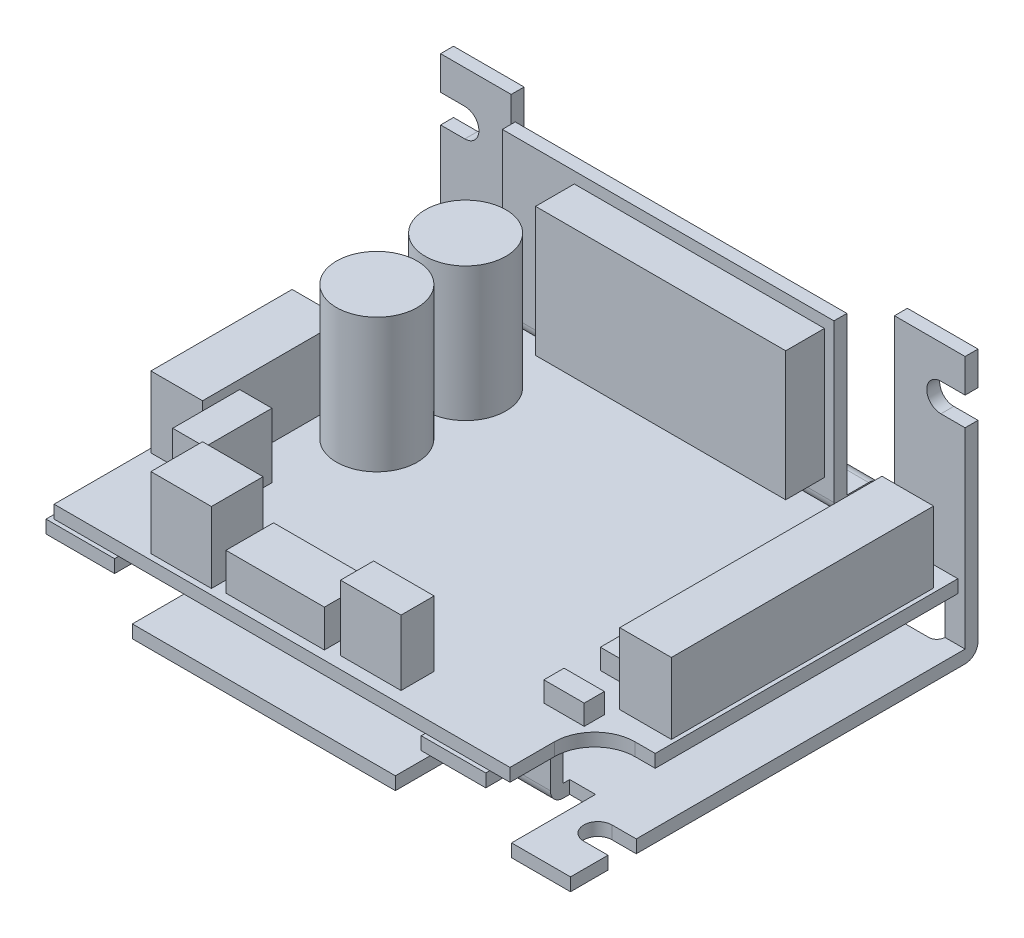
SolidWorks part; units mm, degrees
ref_plane "正面" through (0, 0, 0) normal (0, 0, 1) x (1, 0, 0)
ref_plane "平面" through (0, 0, 0) normal (0, 1, 0) x (1, 0, 0)
ref_plane "右側面" through (0, 0, 0) normal (1, 0, 0) x (0, 0, -1)
sketch "ｽｹｯﾁ1" plane through (0, 0, 0) normal (0, 1, 0) x (1, 0, 0)
  line L0 (-29.5, 42.9555) -> (-29.5, -49957.0445) construction
  line L1 (-32.5, -25.25) -> (32.5, -25.25) construction
  line L2 (-32.5, -25.25) -> (-32.5, 25.25) construction
  line L3 (-32.5, 25.25) -> (32.5, 25.25) construction
  line L4 (32.5, -25.25) -> (32.5, 25.25) construction
  line L5 (-32.5, -25.25) -> (32.5, 25.25) construction
  line L6 (-32.5, 25.25) -> (32.5, -25.25) construction
  line L7 (29.5, 46.0859) -> (29.5, -49953.9141) construction
  line L8 (-48.6184, 12.15) -> (49951.3816, 12.15) construction
  line L9 (-59.4008, -18.85) -> (49940.5992, -18.85) construction
  line L10 (-70.1832, -14.85) -> (49929.8168, -14.85) construction
  line L11 (-29.5, 13.9) -> (-32.5, 13.9) construction
  line L12 (-29.5, 10.4) -> (-32.5, 10.4) construction
  line L13 (29.5, -17.1) -> (32.5, -17.1) construction
  line L14 (29.5, -20.6) -> (32.5, -20.6) construction
  line L15 (-21.8, -14.85) -> (-21.8, -25.25) construction
  line L16 (10.8, -14.85) -> (10.8, -25.25) construction
  line L17 (25.2, -14.85) -> (25.2, -25.25) construction
  line L18 (-32.5, 25.25) -> (-32.5, 13.9)
  line L19 (-32.5, 13.9) -> (-29.5, 13.9)
  line L20 (-29.5, 10.4) -> (-32.5, 10.4)
  line L21 (-32.5, 10.4) -> (-32.5, -17.25)
  line L22 (-32.5, -17.25) -> (-24, -17.25)
  line L23 (-21.8, -14.85) -> (-21.8, -25.25)
  line L24 (-21.8, -25.25) -> (10.8, -25.25)
  line L25 (10.8, -25.25) -> (10.8, -14.85)
  line L26 (14, -14.85) -> (14, -25.25) construction
  line L27 (25.2, -14.85) -> (25.2, -25.25)
  line L28 (25.2, -25.25) -> (32.5, -25.25)
  line L29 (32.5, -25.25) -> (32.5, -20.6)
  line L30 (32.5, -20.6) -> (29.5, -20.6)
  line L31 (29.5, -17.1) -> (32.5, -17.1)
  line L32 (32.5, -17.1) -> (32.5, 25.25)
  line L33 (-54.6043, -17.25) -> (49945.3957, -17.25) construction
  line L34 (-24, -14.85) -> (-24, -25.25) construction
  line L35 (-24, -17.25) -> (-24, -14.85)
  line L36 (-24, -14.85) -> (-21.8, -14.85)
  line L37 (22, -14.85) -> (22, -25.25) construction
  line L38 (10.8, -14.85) -> (14, -14.85)
  line L39 (14, -14.85) -> (14, -17.25)
  line L40 (14, -17.25) -> (22, -17.25)
  line L41 (22, -17.25) -> (22, -14.85)
  line L42 (22, -14.85) -> (25.2, -14.85)
  line L43 (19.5, 21.0496) -> (19.5, -49978.9504) construction
  line L44 (7.8325, -3.75) -> (-49992.1675, -3.75) construction
  line L45 (37.8288, 22.65) -> (50037.8288, 22.65) construction
  line L46 (18.5, -3.75) -> (-14, -3.75)
  line L47 (19.5, -2.75) -> (19.5, 17.25)
  line L48 (16.5, 20.25) -> (-12, 20.25)
  line L49 (-15, -2.75) -> (-15, 17.25)
  line L50 (30, 25.25) -> (30, 22.65) construction
  line L51 (21, 25.25) -> (21, 22.65) construction
  line L52 (-29, 25.25) -> (-29, 22.65) construction
  line L53 (-17, 25.25) -> (-17, 22.65) construction
  line L54 (-32.5, 25.25) -> (-29, 25.25)
  line L55 (-29, 25.25) -> (-29, 23.65)
  line L56 (-28, 22.65) -> (-18, 22.65)
  line L57 (-17, 23.65) -> (-17, 25.25)
  line L58 (-17, 25.25) -> (21, 25.25)
  line L59 (21, 25.25) -> (21, 23.65)
  line L60 (22, 22.65) -> (29, 22.65)
  line L61 (30, 23.65) -> (30, 25.25)
  line L62 (30, 25.25) -> (32.5, 25.25)
  circle A0 centre (-29.5, 12.15) radius 1.75 construction
  circle A1 centre (29.5, -18.85) radius 1.75 construction
  arc A2 (-29.5, 13.9) -> (-29.5, 10.4) centre (-29.5, 12.15) cw
  arc A3 (29.5, -20.6) -> (29.5, -17.1) centre (29.5, -18.85) cw
  arc A4 (18.5, -3.75) -> (19.5, -2.75) centre (18.5, -2.75) ccw
  arc A5 (-14, -3.75) -> (-15, -2.75) centre (-14, -2.75) cw
  arc A6 (19.5, 17.25) -> (16.5, 20.25) centre (16.5, 17.25) ccw
  arc A7 (-12, 20.25) -> (-15, 17.25) centre (-12, 17.25) ccw
  arc A8 (-29, 23.65) -> (-28, 22.65) centre (-28, 23.65) ccw
  arc A9 (-18, 22.65) -> (-17, 23.65) centre (-18, 23.65) ccw
  arc A10 (21, 23.65) -> (22, 22.65) centre (22, 23.65) ccw
  arc A11 (29, 22.65) -> (30, 23.65) centre (29, 23.65) ccw
  point P0 (0, 0)
  point P58 (19.5, -3.75)
  point P61 (-15, -3.75)
  point P64 (19.5, 20.25)
  point P67 (-15, 20.25)
  dimension "D7" = 3.5
  dimension "D9" = 3.5
  dimension "D21" = 1
  dimension "D22" = 3
  dimension "D28" = 1
  dimension "D1" = 65
  dimension "D2" = 50.5
  dimension "D3" = 3
  dimension "D4" = 6.4
  dimension "D5" = 10.4
  dimension "D6" = 31
  dimension "D8" = 3
  dimension "D10" = 10.7
  dimension "D11" = 7.3
  dimension "D12" = 14.4
  dimension "D13" = 8
  dimension "D14" = 8.5
  dimension "D15" = 3.2
  dimension "D16" = 3.2
  dimension "D17" = 13
  dimension "D18" = 29
  dimension "D19" = 34.5
  dimension "D20" = 24
  dimension "D23" = 2.6
  dimension "D24" = 2.5
  dimension "D25" = 9
  dimension "D26" = 38
  dimension "D27" = 12
extrude "押し出し1" add sketch "ｽｹｯﾁ1" along normal blind 1.6
fillet "ﾌｨﾚｯﾄ1" radius 1.6 5 edges at (-30.75, 0, -25.25) (2, 0, -25.25) (31.25, 0, -25.25) (-28.25, 0, 17.25) (18, 0, 17.25)
sketch "ｽｹｯﾁ2" plane through (0, 1.6, 0) normal (0, 1, 0) x (1, 0, 0)
  line L0 (-17.8324, -15.65) -> (49982.1676, -15.65) construction
  line L1 (-32.5, -17.25) -> (-24, -17.25) construction
  line L3 (-32.5, -17.25) -> (-24, -17.25)
  line L4 (-32.5, -17.25) -> (-32.5, -15.65)
  line L5 (-32.5, -15.65) -> (-24, -15.65)
  line L6 (-24, -17.25) -> (-24, -15.65)
  line L7 (14, -17.25) -> (22, -17.25)
  line L8 (14, -17.25) -> (14, -15.65)
  line L9 (14, -15.65) -> (22, -15.65)
  line L10 (22, -17.25) -> (22, -15.65)
  dimension "D1" = 1.6
extrude "押し出し2" add sketch "ｽｹｯﾁ2" along normal blind 5.9
fillet "ﾌｨﾚｯﾄ2" radius 1.6 2 edges at (18, 7.5, 15.65) (-28.25, 7.5, 15.65)
sketch "ｽｹｯﾁ3" plane through (0, 0, 17.25) normal (0, 0, 1) x (1, 0, 0)
  line L0 (22, 7.5) -> (22, 1.6) construction
  line L1 (-32.5, 7.5) -> (-24, 7.5)
  line L2 (-32.5, 7.5) -> (-32.5, 5.9)
  line L3 (-32.5, 5.9) -> (-24, 5.9)
  line L4 (-24, 7.5) -> (-24, 5.9)
  line L5 (14, 7.5) -> (22, 7.5)
  line L6 (14, 7.5) -> (14, 5.9)
  line L7 (14, 5.9) -> (22, 5.9)
  line L8 (22, 7.5) -> (22, 5.9)
  dimension "D1" = 1.6
extrude "押し出し3" add sketch "ｽｹｯﾁ3" along normal blind 8
sketch "ｽｹｯﾁ5" plane through (0, 1.6, 0) normal (0, 1, 0) x (1, 0, 0)
  line L0 (-7.8811, 23.65) -> (49992.1189, 23.65) construction
  line L1 (21, 25.25) -> (-17, 25.25) construction
  line L2 (30, 23.65) -> (30, 25.25)
  line L3 (30, 25.25) -> (32.5, 25.25)
  line L4 (32.5, 25.25) -> (32.5, 23.65)
  line L5 (32.5, 23.65) -> (30, 23.65)
  line L6 (21, 23.65) -> (21, 25.25)
  line L7 (21, 25.25) -> (-17, 25.25)
  line L8 (-17, 25.25) -> (-17, 23.65)
  line L9 (-17, 23.65) -> (21, 23.65)
  line L10 (-29, 23.65) -> (-29, 25.25)
  line L11 (-29, 25.25) -> (-32.5, 25.25)
  line L12 (-32.5, 25.25) -> (-32.5, 23.65)
  line L13 (-32.5, 23.65) -> (-29, 23.65)
  dimension "D1" = 1.6
extrude "押し出し5" add sketch "ｽｹｯﾁ5" along normal blind 6.7
sketch "ｽｹｯﾁ6" plane through (0, 8.3, 0) normal (0, 1, 0) x (1, 0, 0)
  line L1 (-32.5, 23.65) -> (32.5, 23.65)
  line L2 (-32.5, 23.65) -> (-32.5, 25.25)
  line L3 (-32.5, 25.25) -> (32.5, 25.25)
  line L4 (32.5, 23.65) -> (32.5, 25.25)
extrude "押し出し6" add sketch "ｽｹｯﾁ6" along normal blind 2.8
sketch "ｽｹｯﾁ7" plane through (0, 8.3, 0) normal (0, -1, 0) x (1, 0, 0)
  line L0 (30, -25.25) -> (21, -25.25) construction
  line L1 (24, -25.25) -> (27, -25.25)
  line L2 (24, -25.25) -> (24, -23.65)
  line L3 (24, -23.65) -> (27, -23.65)
  line L4 (27, -25.25) -> (27, -23.65)
  line L5 (21, -23.65) -> (30, -23.65) construction
  line L6 (30, -23.65) -> (30, -25.25) construction
  line L7 (-17, -25.25) -> (-29, -25.25) construction
  line L8 (-26, -25.25) -> (-20, -25.25)
  line L9 (-26, -25.25) -> (-26, -23.65)
  line L10 (-26, -23.65) -> (-20, -23.65)
  line L11 (-20, -25.25) -> (-20, -23.65)
  line L12 (-29, -23.65) -> (-17, -23.65) construction
  line L13 (-17, -25.25) -> (-17, -23.65) construction
  dimension "D1" = 3
  dimension "D2" = 3
  dimension "D3" = 3
  dimension "D4" = 6
extrude "押し出し7" add sketch "ｽｹｯﾁ7" along normal blind 2.4
fillet "ﾌｨﾚｯﾄ4" radius 1.6 2 edges at (25.5, 5.9, -25.25) (-23, 5.9, -25.25)
sketch "ｽｹｯﾁ8" plane through (0, 0, -23.65) normal (0, 0, 1) x (1, 0, 0)
  line L0 (-24, 7.5) -> (-32.5, 7.5) construction
  line L1 (24, 5.9) -> (27, 5.9)
  line L2 (24, 5.9) -> (24, 7.5)
  line L3 (24, 7.5) -> (27, 7.5)
  line L4 (27, 5.9) -> (27, 7.5)
  line L5 (-20, 5.9) -> (-26, 5.9)
  line L6 (-20, 5.9) -> (-20, 7.5)
  line L7 (-20, 7.5) -> (-26, 7.5)
  line L8 (-26, 5.9) -> (-26, 7.5)
  line L9 (-26, 5.9) -> (-26, 8.3) construction
extrude "押し出し8" add sketch "ｽｹｯﾁ8" along normal blind 3.4
sketch "ｽｹｯﾁ9" plane through (0, 11.1, 0) normal (0, 1, 0) x (1, 0, 0)
  line L0 (-32.5, 23.65) -> (32.5, 23.65) construction
  line L1 (32.5, 25.25) -> (23.75, 25.25)
  line L2 (32.5, 25.25) -> (32.5, 23.65)
  line L3 (32.5, 23.65) -> (23.75, 23.65)
  line L4 (23.75, 25.25) -> (23.75, 23.65)
  line L5 (32.5, 25.25) -> (-32.5, 25.25) construction
  line L6 (-32.5, 23.65) -> (-23.75, 23.65)
  line L7 (-32.5, 23.65) -> (-32.5, 25.25)
  line L8 (-32.5, 25.25) -> (-23.75, 25.25)
  line L9 (-23.75, 23.65) -> (-23.75, 25.25)
  dimension "D1" = 8.75
  dimension "D2" = 8.75
extrude "押し出し9" add sketch "ｽｹｯﾁ9" along normal blind 21.9
sketch "ｽｹｯﾁ12" plane through (0, 0, -23.65) normal (0, 0, 1) x (1, 0, 0)
  line L0 (-29.6108, 28.85) -> (49970.3892, 28.85) construction
  line L3 (-32.5, 33) -> (-23.75, 33) construction
  line L4 (-46.3034, 25.35) -> (49953.6966, 25.35) construction
  line L5 (-29.5, 45.2209) -> (-29.5, -49954.7791) construction
  line L6 (29.5, 54.6181) -> (29.5, -49945.3819) construction
  line L7 (-32.5, 33) -> (-32.5, 1.6) construction
  line L8 (32.5, 33) -> (32.5, 1.6) construction
  line L9 (-41.0484, 27.1) -> (49958.9516, 27.1) construction
  line L10 (-29.5, 25.35) -> (-32.5, 25.35)
  line L11 (-32.5, 25.35) -> (-32.5, 28.85)
  line L12 (-32.5, 28.85) -> (-29.5, 28.85)
  line L13 (32.5, 25.35) -> (29.5, 25.35)
  line L14 (29.5, 28.85) -> (32.5, 28.85)
  line L15 (32.5, 28.85) -> (32.5, 25.35)
  circle A0 centre (-29.5, 27.1) radius 1.75 construction
  circle A1 centre (29.5, 27.1) radius 1.75 construction
  arc A2 (-29.5, 28.85) -> (-29.5, 25.35) centre (-29.5, 27.1) cw
  arc A3 (29.5, 25.35) -> (29.5, 28.85) centre (29.5, 27.1) cw
  dimension "D6" = 3.5
  dimension "D7" = 3.5
  dimension "D1" = 4.15
  dimension "D2" = 3.5
  dimension "D3" = 3
  dimension "D4" = 3
  dimension "D5" = 1.75
extrude "押し出し10" cut sketch "ｽｹｯﾁ12" against normal up to next
sketch "ｽｹｯﾁ13" plane through (0, 11.1, 0) normal (0, 1, 0) x (1, 0, 0)
  line L0 (23.75, 25.25) -> (-23.75, 25.25) construction
  line L1 (20.55, 25.25) -> (-20.55, 25.25)
  line L2 (20.55, 25.25) -> (20.55, 23.65)
  line L3 (20.55, 23.65) -> (-20.55, 23.65)
  line L4 (-20.55, 25.25) -> (-20.55, 23.65)
  line L5 (-17, 23.65) -> (21, 23.65) construction
  line L6 (32.5, 23.65) -> (32.5, 25.25) construction
  dimension "D1" = 11.95
  dimension "D2" = 41.1
extrude "押し出し11" add sketch "ｽｹｯﾁ13" along normal blind 2.4
fillet "ﾌｨﾚｯﾄ5" radius 1.6 1 edges at (0, 13.5, -25.25)
sketch "ｽｹｯﾁ14" plane through (0, 0, -23.65) normal (0, 0, 1) x (1, 0, 0)
  line L1 (-20.55, 13.5) -> (20.55, 13.5)
  line L2 (-20.55, 13.5) -> (-20.55, 11.9)
  line L3 (-20.55, 11.9) -> (20.55, 11.9)
  line L4 (20.55, 13.5) -> (20.55, 11.9)
extrude "押し出し12" add sketch "ｽｹｯﾁ14" along normal blind 4.3
fillet "ﾌｨﾚｯﾄ6" radius 1.6 1 edges at (0, 11.9, -19.35)
sketch "ｽｹｯﾁ15" plane through (0, 13.5, 0) normal (0, 1, 0) x (1, 0, 0)
  line L0 (20.55, 19.35) -> (20.55, 23.65) construction
  line L1 (-20.55, 19.35) -> (20.55, 19.35)
  line L2 (-20.55, 19.35) -> (-20.55, 20.95)
  line L3 (-20.55, 20.95) -> (20.55, 20.95)
  line L4 (20.55, 19.35) -> (20.55, 20.95)
  dimension "D1" = 1.6
extrude "押し出し13" add sketch "ｽｹｯﾁ15" along normal up to surface (19.5 mm away)
sketch "Sketch1" plane through (0, 7.5, 0) normal (0, 1, 0) x (1, 0, 0)
  line L0 (-32, -24.75) -> (32, -24.75)
  line L1 (32, -24.75) -> (32, 23.25)
  line L2 (32, 23.25) -> (-32, 23.25)
  line L3 (-32, 23.25) -> (-32, -24.75)
  line L4 (-32.5, -25.25) -> (-32.5, -17.25) construction
  line L5 (-24, -25.25) -> (-32.5, -25.25) construction
  line L6 (24.5, -24.75) -> (24.5, -19.25)
  line L7 (29.5, -14.25) -> (32, -14.25)
  line L8 (-24.5, 23.25) -> (-24.5, 11.75)
  line L9 (-29.5, 6.75) -> (-32, 6.75)
  arc A0 (29.5, -14.25) -> (24.5, -19.25) centre (29.5, -19.25) ccw
  arc A1 (-24.5, 11.75) -> (-29.5, 6.75) centre (-29.5, 11.75) cw
  dimension "D9" = 5
  dimension "D1" = 48
  dimension "D2" = 64
  dimension "D3" = 0.5
  dimension "D4" = 0.5
  dimension "D5" = 56.5
  dimension "D6" = 31.5
  dimension "D7" = 10.5
  dimension "D8" = 7.5
extrude "Extrude1" add sketch "Sketch1" along normal blind 1.6 separate body
sketch "Sketch2" plane through (0, 9.1, 0) normal (0, 1, 0) x (1, 0, 0)
  line L0 (-24, -25.25) -> (-32.5, -25.25) construction
  line L1 (-20.7, -17.65) -> (-13.2, -17.65)
  line L2 (-20.7, -17.65) -> (-20.7, -24.05)
  line L3 (-20.7, -24.05) -> (-13.2, -24.05)
  line L4 (-13.2, -17.65) -> (-13.2, -24.05)
  line L5 (-32.5, -25.25) -> (-32.5, -17.25) construction
  dimension "D1" = 6.4
  dimension "D2" = 7.5
  dimension "D3" = 1.2
  dimension "D4" = 11.8
extrude "Extrude2" add sketch "Sketch2" along normal blind 8.8
sketch "Sketch3" plane through (0, 9.1, 0) normal (0, 1, 0) x (-1, 0, 0)
  line L0 (21.8, 25.25) -> (-10.8, 25.25) construction
  line L1 (11.8, 17.75) -> (-0.4, 17.75)
  line L2 (11.8, 17.75) -> (11.8, 23.65)
  line L3 (11.8, 23.65) -> (-0.4, 23.65)
  line L4 (-0.4, 17.75) -> (-0.4, 23.65)
  line L6 (13.2, 24.05) -> (13.2, 17.65) construction
  dimension "D1" = 5.9
  dimension "D2" = 1.6
  dimension "D3" = 1.4
  dimension "D4" = 12.2
extrude "Extrude3" add sketch "Sketch3" along normal blind 4.6
sketch "Sketch4" plane through (0, 9.1, 0) normal (0, 1, 0) x (1, 0, 0)
  line L0 (-21.8, -25.25) -> (10.8, -25.25) construction
  line L1 (2, -19.15) -> (9.5, -19.15)
  line L2 (2, -19.15) -> (2, -23.25)
  line L3 (2, -23.25) -> (9.5, -23.25)
  line L4 (9.5, -19.15) -> (9.5, -23.25)
  line L5 (-32.5, -25.25) -> (-32.5, -17.25) construction
  dimension "D1" = 7.5
  dimension "D2" = 2
  dimension "D3" = 4.1
  dimension "D4" = 34.5
extrude "Extrude4" add sketch "Sketch4" along normal blind 8.1
sketch "Sketch5" plane through (0, 9.1, 0) normal (0, 1, 0) x (1, 0, 0)
  line L0 (-24, -25.25) -> (-32.5, -25.25) construction
  line L1 (-31.5, 4.25) -> (-25.1, 4.25)
  line L2 (-31.5, 4.25) -> (-31.5, -13.25)
  line L3 (-31.5, -13.25) -> (-25.1, -13.25)
  line L4 (-25.1, 4.25) -> (-25.1, -13.25)
  line L5 (-32.5, 10.4) -> (-32.5, -15.65) construction
  dimension "D1" = 12
  dimension "D2" = 17.5
  dimension "D3" = 1
  dimension "D4" = 6.4
extrude "Extrude5" add sketch "Sketch5" along normal blind 8.8
sketch "Sketch6" plane through (0, 9.1, 0) normal (0, 1, 0) x (1, 0, 0)
  line L0 (32.5, -17.1) -> (32.5, 23.65) construction
  line L1 (25.1, 20.75) -> (31.5, 20.75)
  line L2 (25.1, 20.75) -> (25.1, -11.75)
  line L3 (25.1, -11.75) -> (31.5, -11.75)
  line L4 (31.5, 20.75) -> (31.5, -11.75)
  line L5 (25.2, -25.25) -> (32.5, -25.25) construction
  dimension "D1" = 1
  dimension "D2" = 6.4
  dimension "D3" = 13.5
  dimension "D4" = 32.5
extrude "Extrude6" add sketch "Sketch6" along normal blind 8.8
sketch "Sketch7" plane through (0, 9.1, 0) normal (0, 1, 0) x (1, 0, 0)
  line L0 (25.2, -25.25) -> (32.5, -25.25) construction
  line L1 (19.7, -13.25) -> (24.7, -13.25)
  line L2 (19.7, -13.25) -> (19.7, -15.75)
  line L3 (19.7, -15.75) -> (24.7, -15.75)
  line L4 (24.7, -13.25) -> (24.7, -15.75)
  line L5 (19.7, -6.25) -> (24.7, -6.25)
  line L6 (19.7, -6.25) -> (19.7, -8.75)
  line L7 (19.7, -8.75) -> (24.7, -8.75)
  line L8 (24.7, -6.25) -> (24.7, -8.75)
  line L10 (32, -14.25) -> (32, 23.25) construction
  dimension "D1" = 2.5
  dimension "D2" = 9.5
  dimension "D3" = 5
  dimension "D4" = 7.3
  dimension "D5" = 4.5
  dimension "D6" = 2.5
extrude "Extrude7" add sketch "Sketch7" along normal blind 2.5
sketch "Sketch8" plane through (0, 0, -19.35) normal (0, 0, 1) x (1, 0, 0)
  line L0 (32.5, 25.35) -> (32.5, 1.6) construction
  line L1 (-11.63, 31.6) -> (19.37, 31.6)
  line L2 (-11.63, 31.6) -> (-11.63, 15.6)
  line L3 (-11.63, 15.6) -> (19.37, 15.6)
  line L4 (19.37, 31.6) -> (19.37, 15.6)
  line L5 (20.55, 33) -> (-20.55, 33) construction
  dimension "D1" = 31
  dimension "D2" = 13.13
  dimension "D3" = 1.4
  dimension "D4" = 16
extrude "Extrude8" add sketch "Sketch8" along normal blind 4.8
sketch "Sketch9" plane through (0, 9.1, 0) normal (0, 1, 0) x (1, 0, 0)
  line L0 (-24, -25.25) -> (-32.5, -25.25) construction
  line L1 (-32.5, -25.25) -> (-32.5, -17.25) construction
  circle A0 centre (-19, 2.25) radius 5
  circle A1 centre (-19, 13.25) radius 5
  dimension "D1" = 10
  dimension "D2" = 10
  dimension "D3" = 27.5
  dimension "D4" = 13.5
  dimension "D5" = 11
extrude "Extrude9" add sketch "Sketch9" along normal blind 16.6
sketch "Sketch10" plane through (0, 9.1, 0) normal (0, 1, 0) x (1, 0, 0)
  line L0 (-24, -25.25) -> (-32.5, -25.25) construction
  line L1 (-20.8, -8.95) -> (-24.8, -8.95)
  line L2 (-20.8, -8.95) -> (-20.8, -17.25)
  line L3 (-20.8, -17.25) -> (-24.8, -17.25)
  line L4 (-24.8, -8.95) -> (-24.8, -17.25)
  line L5 (-32.5, -25.25) -> (-32.5, -17.25) construction
  dimension "D1" = 8
  dimension "D2" = 4
  dimension "D3" = 8.3
  dimension "D4" = 7.7
extrude "Extrude10" add sketch "Sketch10" along normal blind 8
